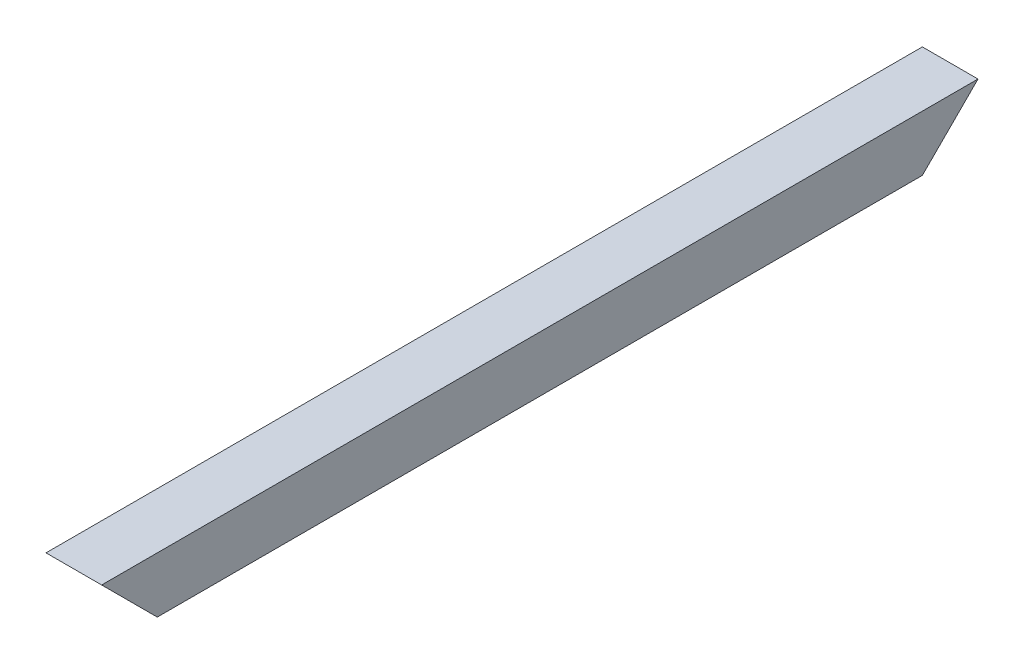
SolidWorks part; units mm, degrees
ref_plane "Plan de face" through (0, 0, 0) normal (0, 0, 1) x (1, 0, 0)
ref_plane "Plan de dessus" through (0, 0, 0) normal (0, 1, 0) x (1, 0, 0)
ref_plane "Plan de droite" through (0, 0, 0) normal (1, 0, 0) x (0, 0, -1)
sketch "Esquisse1" plane through (0, 0, 0) normal (0, 0, 1) x (1, 0, 0)
  line L1 (0, 80) -> (80, 80)
  line L2 (0, 80) -> (0, 0)
  line L3 (0, 0) -> (80, 0)
  line L4 (80, 80) -> (80, 0)
  line L5 (3, 77) -> (77, 77)
  line L6 (3, 77) -> (3, 3)
  line L7 (3, 3) -> (77, 3)
  line L8 (77, 77) -> (77, 3)
  dimension "D1" = 80
  dimension "D2" = 80
  dimension "D3" = 3
  dimension "D4" = 3
  dimension "D5" = 3
  dimension "D6" = 3
extrude "Extrusion1" add sketch "Esquisse1" along normal blind 1260
ref_plane "Plan1" through (0, 0, 630) normal (0, 0, 1) x (1, 0, 0)
chamfer "Chanfrein1" distance 80 1 edges at (40, 0, 1260)
chamfer "Chanfrein2" distance 80 1 edges at (40, 0, 0)
